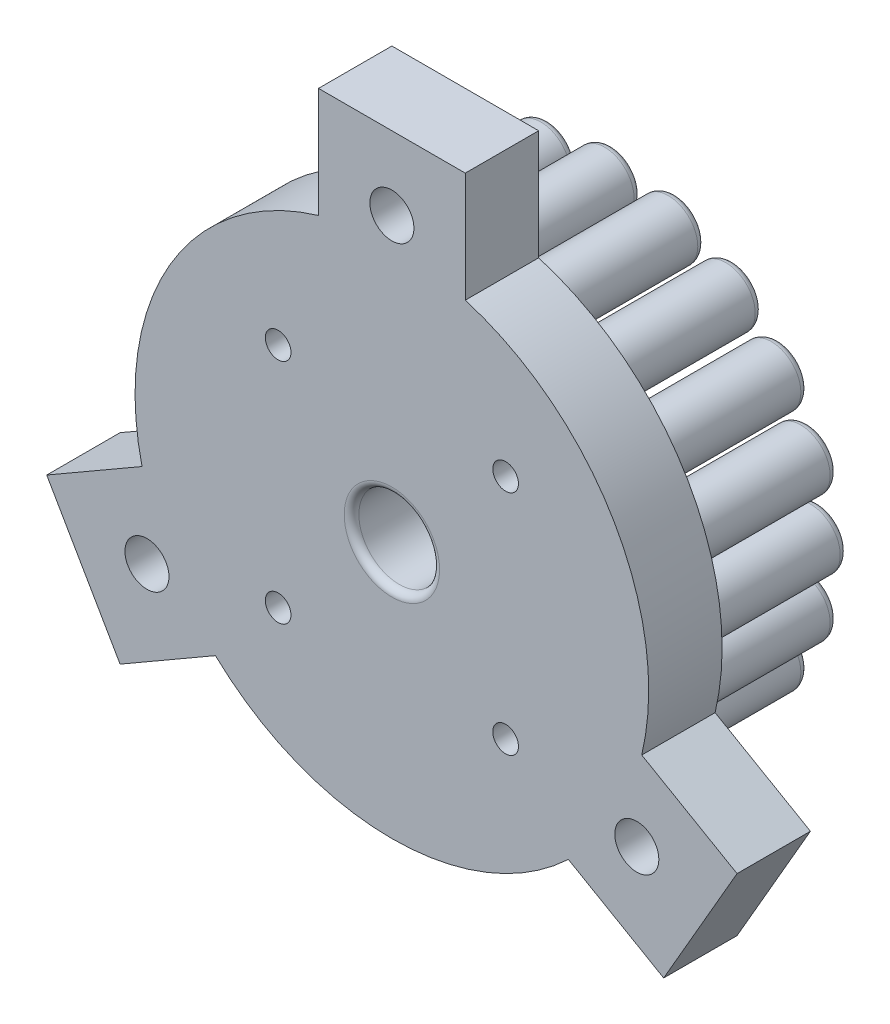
SolidWorks part; units mm, degrees
ref_plane "Ebene vorne" through (0, 0, 0) normal (0, 0, 1) x (1, 0, 0)
ref_plane "Ebene oben" through (0, 0, 0) normal (0, 1, 0) x (1, 0, 0)
ref_plane "Ebene rechts" through (0, 0, 0) normal (1, 0, 0) x (0, 0, -1)
sketch "Skizze1" plane through (0, 0, 0) normal (0, 0, 1) x (1, 0, 0)
  circle A0 centre (0, 0) radius 28.1
  circle A1 centre (0, 28.1) radius 4
  circle A2 centre (8.6834, 26.7247) radius 4
  circle A3 centre (16.5168, 22.7334) radius 4
  circle A4 centre (22.7334, 16.5168) radius 4
  circle A5 centre (26.7247, 8.6834) radius 4
  circle A6 centre (28.1, 0) radius 4
  circle A7 centre (26.7247, -8.6834) radius 4
  circle A8 centre (22.7334, -16.5168) radius 4
  circle A9 centre (16.5168, -22.7334) radius 4
  circle A10 centre (8.6834, -26.7247) radius 4
  circle A11 centre (0, -28.1) radius 4
  circle A12 centre (-8.6834, -26.7247) radius 4
  circle A13 centre (-16.5168, -22.7334) radius 4
  circle A14 centre (-22.7334, -16.5168) radius 4
  circle A15 centre (-26.7247, -8.6834) radius 4
  circle A16 centre (-28.1, 0) radius 4
  circle A17 centre (-26.7247, 8.6834) radius 4
  circle A18 centre (-22.7334, 16.5168) radius 4
  circle A19 centre (-16.5168, 22.7334) radius 4
  circle A20 centre (-8.6834, 26.7247) radius 4
  point P36 (0, 0)
  dimension "D1" = 56.2
  dimension "D2" = 20
  dimension "D3" = 8
extrude "Aufsatz-Linear austragen1" add sketch "Skizze1" along normal blind 20 contours A5 | A4 | A3 | A2 | A1 | A13 | A12 | A11 | A10 | A9 | A8 | A7 | A6 | A14 | A15 | A16 | A17 | A18 | A19 | A20
sketch "Skizze5" plane through (0, 0, 20) normal (0, 0, 1) x (1, 0, 0)
  circle A0 centre (0, 0) radius 35
  dimension "D1" = 70
extrude "Aufsatz-Linear austragen2" add sketch "Skizze5" along normal blind 10
sketch "Skizze6" plane through (0, 0, 30) normal (0, 0, 1) x (1, 0, 0)
  circle A0 centre (0, 0) radius 5.5
  dimension "D1" = 11
extrude "Schnitt-Linear austragen1" cut sketch "Skizze6" against normal blind 10
ref_plane "Ebene2" through (0, 0, 30) normal (0, 0, 1) x (1, 0, 0)
sketch "Skizze7" plane through (0, 0, 30) normal (0, 0, 1) x (1, 0, 0)
  line L1 (-10, 33.541) -> (10, 33.541)
  line L2 (-10, 33.541) -> (-10, 48.541)
  line L3 (-10, 48.541) -> (10, 48.541)
  line L4 (10, 33.541) -> (10, 48.541)
  line L12 (34.0474, -8.1103) -> (47.0378, -15.6103)
  line L13 (34.0474, -8.1103) -> (24.0474, -25.4308)
  line L14 (24.0474, -25.4308) -> (37.0378, -32.9308)
  line L15 (47.0378, -15.6103) -> (37.0378, -32.9308)
  line L16 (-24.0474, -25.4308) -> (-37.0378, -32.9308)
  line L17 (-24.0474, -25.4308) -> (-34.0474, -8.1103)
  line L18 (-34.0474, -8.1103) -> (-47.0378, -15.6103)
  line L19 (-37.0378, -32.9308) -> (-47.0378, -15.6103)
  circle A0 centre (0, 0) radius 35 construction
  point P18 (0, 0)
  dimension "D1" = 20
  dimension "D2" = 10
  dimension "D3" = 15
  dimension "D4" = 3
extrude "Aufsatz-Linear austragen3" add sketch "Skizze7" against normal blind 10
sketch "Skizze9" plane through (0, 0, 30) normal (0, 0, 1) x (1, 0, 0)
  line L0 (10, 48.541) -> (-10, 48.541) construction
  circle A0 centre (0, 38.541) radius 3
  circle A1 centre (33.3775, -19.2705) radius 3
  circle A2 centre (-33.3775, -19.2705) radius 3
  point P11 (0, 0)
  dimension "D1" = 6
  dimension "D2" = 10
  dimension "D3" = 3
extrude "Schnitt-Linear austragen3" cut sketch "Skizze9" against normal up to next
fillet "Verrundung1" radius 1 2 edges at (5.5, 0, 20) (5.5, 0, 30)
fillet "Verrundung2" radius 1 20 edges at (30.7247, 8.6834, 0) (-12.5168, -22.7334, 0) (-4.6834, -26.7247, 0) (4, -28.1, 0) (12.6834, -26.7247, 0) (20.5168, -22.7334, 0) (26.7334, -16.5168, 0) (30.7247, -8.6834, 0) (32.1, 0, 0) (26.7334, 16.5168, 0) (20.5168, 22.7334, 0) (12.6834, 26.7247, 0) (-18.7334, -16.5168, 0) (-22.7247, -8.6834, 0) (-24.1, 0, 0) (-22.7247, 8.6834, 0) (-18.7334, 16.5168, 0) (-12.5168, 22.7334, 0) (-4.6834, 26.7247, 0) (4, 28.1, 0)
sketch "Skizze10" plane through (0, 0, 30) normal (0, 0, 1) x (1, 0, 0)
  line L1 (-15.5, 15.5) -> (15.5, 15.5)
  line L2 (-15.5, 15.5) -> (-15.5, -15.5)
  line L3 (-15.5, -15.5) -> (15.5, -15.5)
  line L4 (15.5, 15.5) -> (15.5, -15.5)
  circle A0 centre (-15.5, 15.5) radius 1.75
  circle A1 centre (15.5, 15.5) radius 1.75
  circle A2 centre (15.5, -15.5) radius 1.75
  circle A3 centre (-15.5, -15.5) radius 1.75
  dimension "D5" = 3.5
  dimension "D1" = 31
  dimension "D2" = 31
  dimension "D3" = 15.5
  dimension "D4" = 15.5
extrude "Schnitt-Linear austragen4" cut sketch "Skizze10" against normal blind 10 contours A1 | A0 | A3 | A2
sketch "Skizze12" plane through (0, 0, 20) normal (0, 0, -1) x (-1, 0, 0)
  circle A0 centre (-15.5, 15.5) radius 3.3
  circle A1 centre (15.5, 15.5) radius 3.3
  circle A2 centre (-15.5, -15.5) radius 3.3
  circle A3 centre (15.5, -15.5) radius 3.3
extrude "Schnitt-Linear austragen5" cut sketch "Skizze12" against normal blind 3
